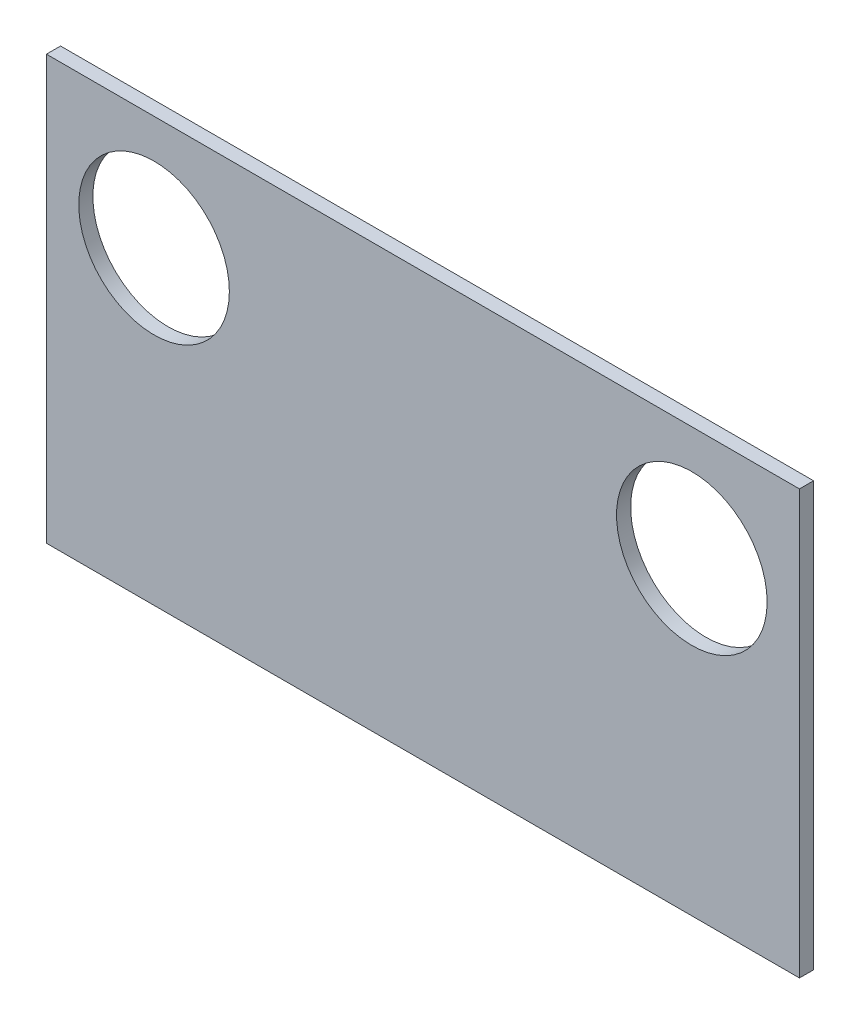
SolidWorks part; units mm, degrees
ref_plane "Plan de face" through (0, 0, 0) normal (0, 0, 1) x (1, 0, 0)
ref_plane "Plan de dessus" through (0, 0, 0) normal (0, 1, 0) x (1, 0, 0)
ref_plane "Plan de droite" through (0, 0, 0) normal (1, 0, 0) x (0, 0, -1)
sketch "Esquisse1" plane through (0, 0, 0) normal (0, 0, 1) x (1, 0, 0)
  line L0 (-6.5, 11.545) -> (6.5, 11.545) construction
  line L1 (-8, 20.545) -> (8, 20.545)
  line L2 (-8, 20.545) -> (-8, 11.545)
  line L3 (-8, 11.545) -> (8, 11.545)
  line L4 (8, 20.545) -> (8, 11.545)
  line L5 (0, 17) -> (0, 24.1626) construction
  circle A0 centre (-5.7134, 18.1206) radius 1.6
  circle A1 centre (5.7134, 18.1206) radius 1.6
  dimension "D1" = 3.2
  dimension "D2" = 16
  dimension "D3" = 9
extrude "Boss.-Extru.1" add sketch "Esquisse1" along normal blind 0.3 from offset 0.65
